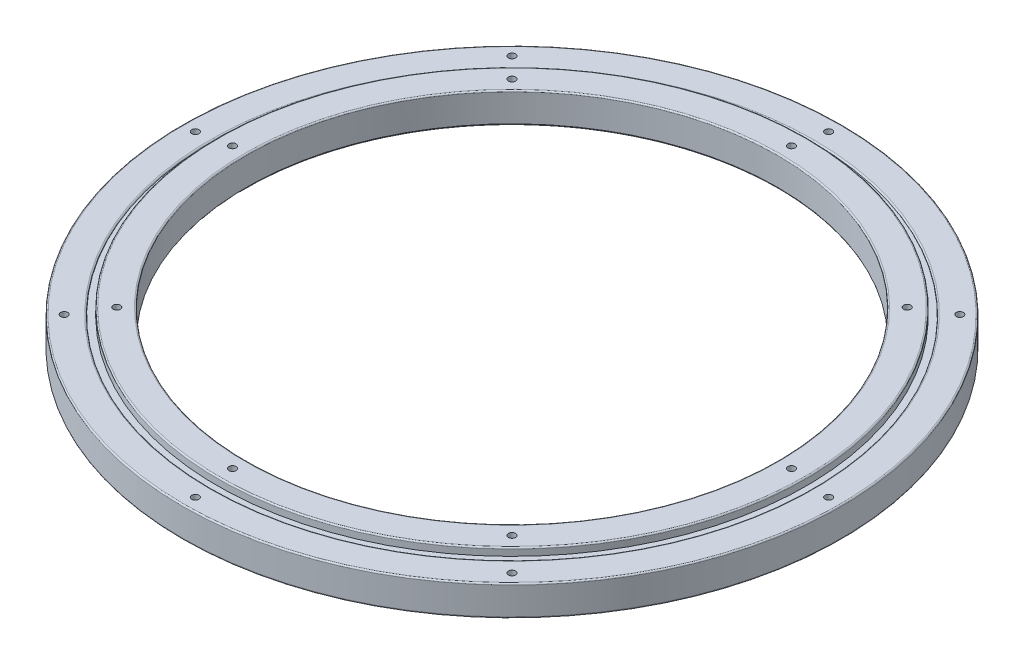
SolidWorks part; units mm, degrees
other "<T&B Turntable>-<CirPattern1>"
ref_plane "Front" through (0, 0, 0) normal (0, 0, 1) x (1, 0, 0)
ref_plane "Top" through (0, 0, 0) normal (0, 1, 0) x (1, 0, 0)
ref_plane "Right" through (0, 0, 0) normal (1, 0, 0) x (0, 0, -1)
inserted part "T&B Turntable"
move or copy body "Body-Move/Copy2" parameters "D1"=0, "D2"=0, "D3"=0
hole_wizard "M6x1.0 Tapped Hole1" positions "Sketch1" profile "Sketch2" tap size "M6x1.0" standard "ANSI Metric"
sketch "Sketch1" plane through (0, 16.5608, 0) normal (0, 1, 0) x (1, 0, 0)
  point P0 (-112.2399, 64.8018)
  point P3 (-126.45, 73.006)
  point P6 (0, 129.6035)
  point P9 (0, 146.0119)
  point P12 (112.2399, 64.8017)
  point P15 (126.45, 73.0059)
  point P18 (112.2399, -64.8018)
  point P21 (126.45, -73.006)
  point P24 (0, -129.6035)
  point P27 (0, -146.0119)
  point P30 (-126.45, -73.0059)
  point P33 (-112.2399, -64.8017)
sketch "Sketch2" plane through (-112.2399, 16.5608, -64.8018) normal (1, 0, 0) x (0, 0, 1)
  line L0 (0, 0) -> (0, 16.5608)
  line L1 (0, 16.5608) -> (2.5, 16.5608)
  line L2 (2.5, 16.5608) -> (2.5, 0)
  line L5 (2.5, 0) -> (0, 0)
  line L11 (0, -6.35) -> (0, 107.95) construction
  dimension "Thru Tap Drill Dia." = 5
  dimension "Thru Tap Drill Depth" = 16.5608
sketch "Sketch5" plane through (0, 16.9, 0) normal (0, 1, 0) x (1, 0, 0)
  circle A0 centre (0, 129.6035) radius 3.7143
extrude "Plug 1" add sketch "Sketch5" against normal up to surface (14 mm away)
sketch "Sketch6" plane through (0, 14, 0) normal (0, 1, 0) x (1, 0, 0)
  circle A0 centre (0, 146.0119) radius 3.3222
extrude "Plug 2" add sketch "Sketch6" against normal up to surface (14 mm away)
pattern_circular "CirPattern2" count 6 over 360 about axis through (0, 0, 0) along (0, -1, 0) of "Plug 1", "Plug 2"
hole_wizard "M4x0.7 Tapped Hole1" positions "Sketch3" profile "Sketch4" tap size "M4x0.7" standard "ANSI Metric"
sketch "Sketch3" plane through (0, 16.9, 0) normal (0, 1, 0) x (1, 0, 0)
  line L2 (0, -128.905) -> (0, 0) construction
  circle A0 centre (0, 0) radius 128.905 construction
  circle A1 centre (0, 0) radius 146.05 construction
  point P0 (0, -146.05)
  point P20 (0, -128.905)
  dimension "D1" = 128.905
  dimension "D2" = 146.05
sketch "Sketch4" plane through (0, 16.9, 146.05) normal (1, 0, 0) x (0, 0, 1)
  line L0 (0, 0) -> (0, 16.9)
  line L1 (0, 16.9) -> (1.65, 16.9)
  line L2 (1.65, 16.9) -> (1.65, 0)
  line L5 (1.65, 0) -> (0, 0)
  line L11 (0, -6.35) -> (0, 107.95) construction
  dimension "Thru Tap Drill Dia." = 3.3
  dimension "Thru Tap Drill Depth" = 16.9
pattern_circular "CirPattern1" count 8 over 360 about axis through (0, 0, 0) along (0, 1, 0) of "M4x0.7 Tapped Hole1"
hole_wizard "M3x0.5 Tapped Hole1" positions "Sketch7" profile "Sketch8" tap size "M3x0.5" standard "ANSI Metric"
sketch "Sketch7" plane through (0, 14.1478, 0) normal (0, 1, 0) x (1, 0, 0)
  line L0 (-15.24, -145.2527) -> (15.24, -145.2527) construction
  line L4 (0, -146.05) -> (0, 0) construction
  circle A0 centre (0, 0) radius 146.05 construction
  point P0 (-15.24, -145.2527)
  point P2 (15.24, -145.2527)
  point P26 (0, -145.2527)
  dimension "D1" = 30.48
sketch "Sketch8" plane through (-15.24, 14.1478, 145.2527) normal (1, 0, 0) x (0, 0, 1)
  line L0 (0, 0) -> (0, 14.1478)
  line L1 (0, 14.1478) -> (1.25, 14.1478)
  line L2 (1.25, 14.1478) -> (1.25, 0)
  line L5 (1.25, 0) -> (0, 0)
  line L11 (0, -6.35) -> (0, 107.95) construction
  dimension "Thru Tap Drill Dia." = 2.5
  dimension "Thru Tap Drill Depth" = 14.1478
pattern_circular "CirPattern3" [suppressed] count 3 over 360
